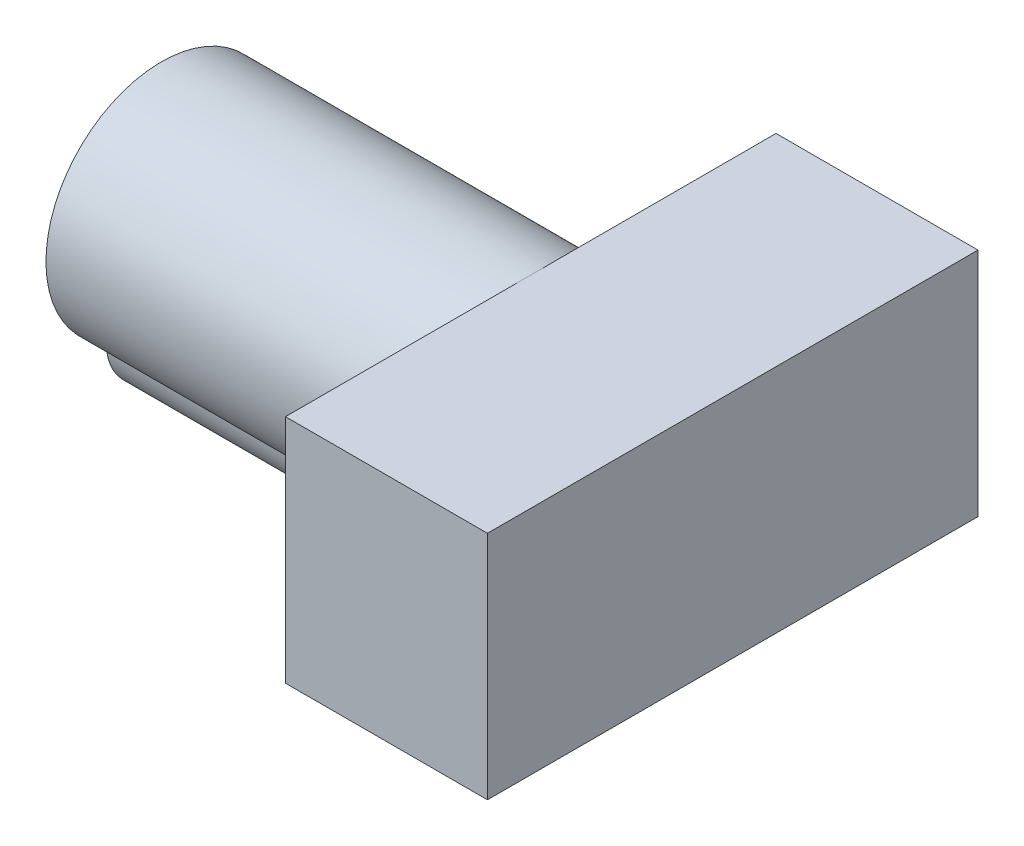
SolidWorks part; units mm, degrees
ref_plane "Front Plane" through (0, 0, 0) normal (0, 0, 1) x (1, 0, 0)
ref_plane "Top Plane" through (0, 0, 0) normal (0, 1, 0) x (1, 0, 0)
ref_plane "Right Plane" through (0, 0, 0) normal (1, 0, 0) x (0, 0, -1)
sketch "Sketch1" plane through (0, 0, 0) normal (0, 1, 0) x (1, 0, 0)
  line L1 (0, 0) -> (44.45, 0)
  line L2 (0, 0) -> (0, 107.95)
  line L3 (0, 107.95) -> (44.45, 107.95)
  line L4 (44.45, 0) -> (44.45, 107.95)
  dimension "D1" = 107.95
  dimension "D2" = 44.45
extrude "Boss-Extrude1" add sketch "Sketch1" along normal blind 50.8
sketch "Sketch4" plane through (0, 0, 0) normal (-1, 0, 0) x (0, 0, 1)
  circle A0 centre (-53.975, 25.4) radius 25.4
extrude "Boss-Extrude2" add sketch "Sketch4" along normal blind 81.28
ref_plane "Plane1" through (0, 0, 0) normal (0, -1, 0) x (-1, 0, 0)
sketch "Sketch5" plane through (0, 0, 0) normal (0, -1, 0) x (-1, 0, 0)
  line L1 (81.28, 67.2215) -> (30.48, 67.2215)
  line L2 (81.28, 67.2215) -> (81.28, 41.8215)
  line L3 (81.28, 41.8215) -> (30.48, 41.8215)
  line L4 (30.48, 67.2215) -> (30.48, 41.8215)
  line L6 (81.28, 28.575) -> (81.28, 79.375) construction
  dimension "D1" = 25.4
  dimension "D2" = 50.8
extrude "Boss-Extrude3" add sketch "Sketch5" along normal blind 12.7 and the other way blind 12.7
sketch "Sketch6" plane through (-81.28, 0, 0) normal (-1, 0, 0) x (0, 0, 1)
  line L0 (-67.2215, 3.7277) -> (-67.2215, -12.7)
  line L1 (-67.2215, -12.7) -> (-41.8215, -12.7)
  line L2 (-41.8215, -12.7) -> (-41.8215, 3.0964)
  arc A0 (-67.2215, 3.7277) -> (-41.8215, 3.0964) centre (-54.5215, 3.412) ccw
extrude "Cut-Extrude1" cut sketch "Sketch6" against normal blind 55.88 contours A0 L0 M3 M4
